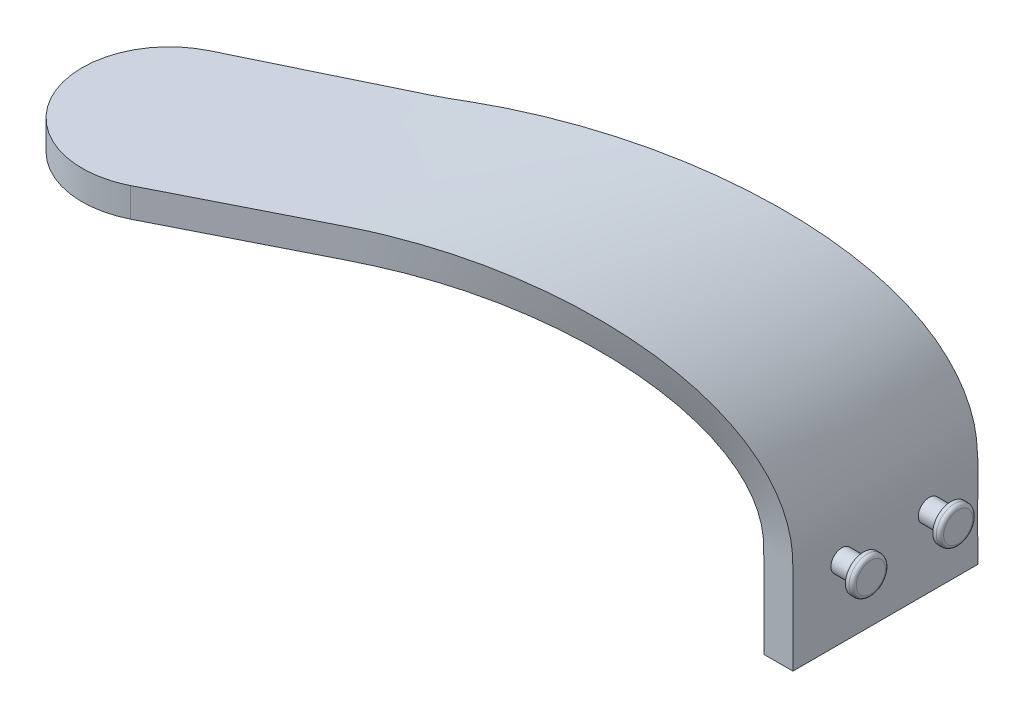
SolidWorks part; units mm, degrees
ref_plane "Front Plane" through (0, 0, 0) normal (0, 0, 1) x (1, 0, 0)
ref_plane "Top Plane" through (0, 0, 0) normal (0, 1, 0) x (1, 0, 0)
ref_plane "Right Plane" through (0, 0, 0) normal (1, 0, 0) x (0, 0, -1)
imported_body "Stock-Binding Start Sketch_&-1"
sketch "Sketch1" plane through (2.9998, 0, 0) normal (1, 0, 0) x (0, 0, -1)
  line L0 (-12.6894, 17) -> (-12.6894, -4.6595) construction
  line L1 (-6.1894, 17) -> (-19.1894, 17) construction
  circle A0 centre (-18.6894, 9.8312) radius 1.5
  circle A1 centre (-6.6894, 9.8312) radius 1.5
  arc A2 (-5.3776, 7.0835) -> (-10.0494, 9.5438) centre (-12.6894, -1.1347) ccw construction
  arc A3 (-3.3835, 9.3248) -> (-9.3294, 12.4562) centre (-12.6894, -1.1347) ccw construction
  dimension "D1" = 12
extrude "Boss-Extrude1" add sketch "Sketch1" against normal up to next
sketch "Sketch2" plane through (2.9998, 0, 0) normal (1, 0, 0) x (0, 0, -1)
  circle A2 centre (-18.6894, 9.8312) radius 2.5
  circle A3 centre (-18.6894, 9.8312) radius 2.5
  circle A5 centre (-6.6894, 9.8312) radius 2.5
  circle A6 centre (-6.6894, 9.8312) radius 2.5
  dimension "D1" = 1
  dimension "D2" = 1
extrude "Boss-Extrude2" add sketch "Sketch2" along normal blind 1
fillet "Fillet1" radius 0.5 2 edges at (3.9998, 9.8312, 4.1893) (3.9999, 9.8312, 16.1893)
